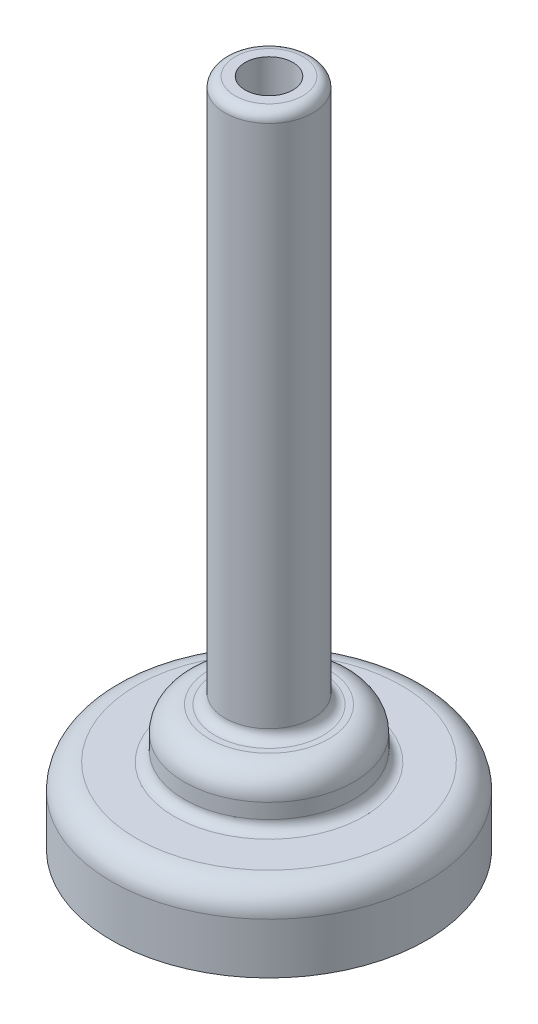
SolidWorks part; units mm, degrees
ref_plane "Front" through (0, 0, 0) normal (0, 0, 1) x (1, 0, 0)
ref_plane "Top" through (0, 0, 0) normal (0, 1, 0) x (1, 0, 0)
ref_plane "Right" through (0, 0, 0) normal (1, 0, 0) x (0, 0, -1)
sketch "Sketch1"
  dimension "D1" = 20.066
  dimension "D2" = 10.795
  dimension "D3" = 5.588
  dimension "D4" = 42.672
  dimension "D5" = 4.826
  dimension "D6" = 8.001
  dimension "D7" = 3.175
revolve "Base-Revolve" add sketch "Sketch1" angle 360 about L0
fillet "Fillet1" radius 1.5875 2 edges at (0, 4.826, -10.033) (0, 8.001, -5.3975)
shell "Shell1" thickness 1.27
sketch "Sketch2"
  dimension "D1" = 16.51
extrude "Boss-Extrude1" add sketch "Sketch2" against normal up to surface (3.556 mm away)
fillet "Fillet2" radius 0.635 6 edges at (0, 6.731, 1.524) (0, 3.556, 4.1275) (0, 3.556, 8.255) (0, 4.826, -5.3975) (0, 8.001, -2.794) (0, 42.672, -2.794)
